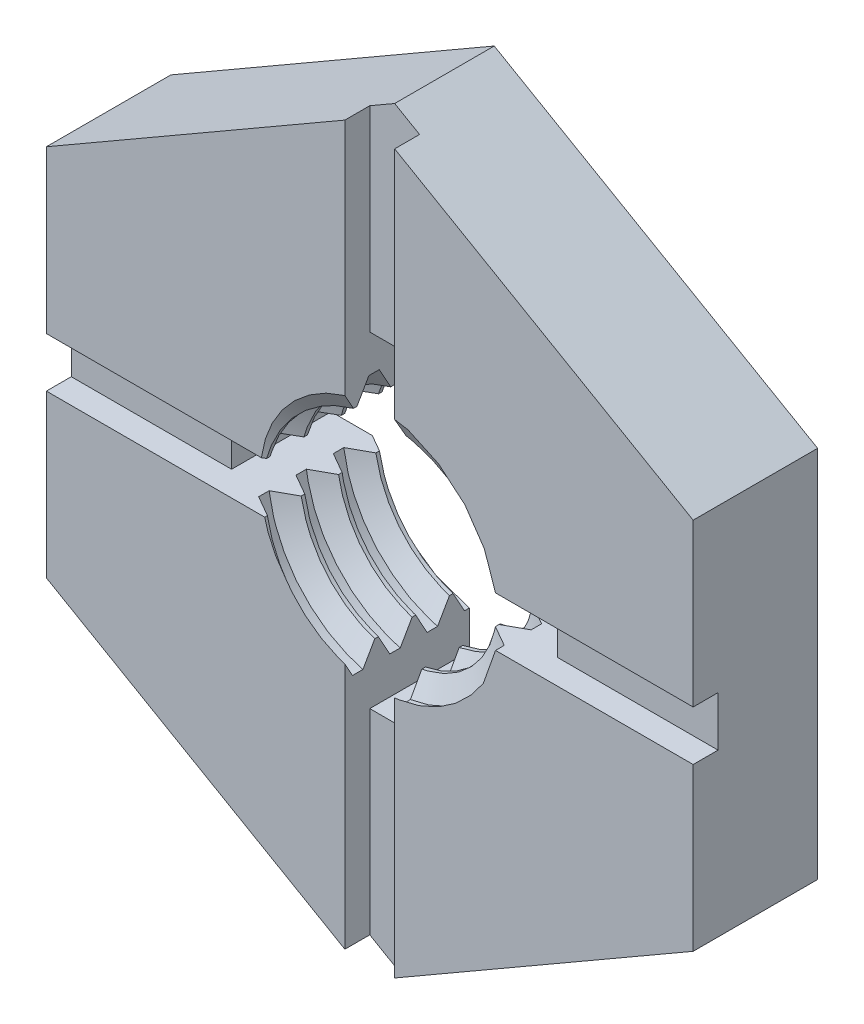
SolidWorks part; units mm, degrees
ref_plane "Спереди" through (0, 0, 0) normal (0, 0, 1) x (1, 0, 0)
ref_plane "Сверху" through (0, 0, 0) normal (0, 1, 0) x (1, 0, 0)
ref_plane "Справа" through (0, 0, 0) normal (1, 0, 0) x (0, 0, -1)
sketch "Эскиз1" plane through (0, 0, 0) normal (0, 0, 1) x (1, 0, 0)
  line L0 (-21.7519, 32.5498) -> (-21.7519, -22.4472) construction
  line L1 (-37.2424, 11.4339) -> (0.0071, 11.4339) construction
  line L2 (-50.4459, 3.9339) -> (7.1015, 3.9339) construction
  line L3 (-34.7423, 11.4339) -> (-21.7519, 18.9339)
  line L4 (-4.6381, -3.5661) -> (-44.0301, -3.5661) construction
  line L5 (-21.7519, 18.9339) -> (-8.7615, 11.4339)
  line L6 (-8.7615, 11.4339) -> (-8.7615, -3.5661)
  line L7 (-8.7615, -3.5661) -> (-21.7519, -11.0661)
  line L8 (-21.7519, -11.0661) -> (-34.7423, -3.5661)
  line L9 (-34.7423, -3.5661) -> (-34.7423, 11.4339)
  circle A1 centre (-21.7519, 3.9339) radius 15 construction
  circle A2 centre (-21.7519, 18.9339) radius 15 construction
  circle A3 centre (-21.7519, -11.0661) radius 15 construction
  dimension "D1" = 30
  dimension "D2" = 30
  dimension "D3" = 15
  dimension "D4" = 15
  dimension "D5" = 15
  dimension "D6" = 15
extrude "Бобышка-Вытянуть1" add sketch "Эскиз1" along normal blind 5
other "Отступ1" parameters "D1"=10, "D2"=0.2
sketch "Эскиз4" plane through (0, 0, 5) normal (0, 0, 1) x (1, 0, 0)
  line L0 (-39.49, 3.9339) -> (-6.1401, 3.9339) construction
  line L1 (-21.7519, 21.2243) -> (-21.7519, -13.0881) construction
  line L2 (-28.3019, 4.9339) -> (-15.2019, 4.9339)
  line L3 (-28.3019, 2.9339) -> (-15.2019, 2.9339)
  line L4 (-22.7519, 10.4839) -> (-22.7519, -2.6161)
  line L5 (-20.7519, 10.4839) -> (-20.7519, -2.6161)
  line L6 (-8.7615, -3.5661) -> (-8.7615, 11.4339)
  line L7 (-8.7615, 11.4339) -> (-21.7519, 18.9339)
  line L8 (-21.7519, 18.9339) -> (-34.7423, 11.4339)
  line L9 (-34.7423, 11.4339) -> (-34.7423, -3.5661)
  line L10 (-34.7423, -3.5661) -> (-21.7519, -11.0661)
  line L11 (-21.7519, -11.0661) -> (-8.7615, -3.5661)
  line L12 (-8.7615, -3.5661) -> (-8.7615, 11.4339)
  line L13 (-8.7615, 11.4339) -> (-21.7519, 18.9339)
  line L14 (-21.7519, 18.9339) -> (-34.7423, 11.4339)
  line L15 (-34.7423, 11.4339) -> (-34.7423, -3.5661)
  line L16 (-34.7423, -3.5661) -> (-21.7519, -11.0661)
  line L17 (-21.7519, -11.0661) -> (-8.7615, -3.5661)
  line L18 (-22.7519, 10.4839) -> (-20.7519, 10.4839)
  line L19 (-22.7519, -2.6161) -> (-20.7519, -2.6161)
  line L20 (-28.3019, 4.9339) -> (-28.3019, 2.9339)
  line L21 (-15.2019, 4.9339) -> (-15.2019, 2.9339)
  line L22 (-26.0019, 5.5052) -> (-26.0019, 2.0869) construction
  line L23 (-17.5019, 5.2803) -> (-17.5019, 2.3567) construction
  line L24 (-23.1297, 8.1839) -> (-19.3965, 8.1839) construction
  line L25 (-23.1072, -0.3161) -> (-19.8688, -0.3161) construction
  circle A0 centre (-21.7519, 3.9339) radius 4.25
  dimension "D8" = 8.5
  dimension "D2" = 15
  dimension "D3" = 7.5
  dimension "D4" = 1
  dimension "D5" = 1
  dimension "D6" = 1
  dimension "D7" = 1
  dimension "D9" = 2.3
  dimension "D10" = 2.3
  dimension "D11" = 2.3
  dimension "D12" = 2.3
  dimension "D1" = 0
extrude "Вырез-Вытянуть1" cut sketch "Эскиз4" against normal up to surface (5 mm away)
sketch "Эскиз5" plane through (0, 0, 5) normal (0, 0, 1) x (1, 0, 0)
  line L0 (-20.7519, 10.4839) -> (-20.7519, 8.9405) construction
  line L1 (-16.6999, 4.9339) -> (-15.2019, 4.9339) construction
  line L2 (-16.6999, 2.9339) -> (-15.2019, 2.9339) construction
  line L6 (-22.7519, 18.3565) -> (-22.7519, -10.4888)
  line L7 (-20.7519, 18.3565) -> (-20.7519, -10.4888)
  line L8 (-34.7423, 4.9339) -> (-8.7615, 4.9339)
  line L9 (-34.7423, 2.9339) -> (-8.7615, 2.9339)
  line L10 (-22.7519, 10.4839) -> (-22.7519, 8.7746) construction
  line L12 (-8.7615, -3.5661) -> (-8.7615, 11.4339)
  line L13 (-8.7615, 11.4339) -> (-21.7519, 18.9339)
  line L14 (-21.7519, 18.9339) -> (-34.7423, 11.4339)
  line L15 (-34.7423, 11.4339) -> (-34.7423, -3.5661)
  line L16 (-34.7423, -3.5661) -> (-21.7519, -11.0661)
  line L17 (-21.7519, -11.0661) -> (-8.7615, -3.5661)
  line L18 (-8.7615, -3.5661) -> (-8.7615, 11.4339)
  line L19 (-8.7615, 11.4339) -> (-21.7519, 18.9339)
  line L20 (-21.7519, 18.9339) -> (-34.7423, 11.4339)
  line L21 (-34.7423, 11.4339) -> (-34.7423, -3.5661)
  line L22 (-34.7423, -3.5661) -> (-21.7519, -11.0661)
  line L23 (-21.7519, -11.0661) -> (-8.7615, -3.5661)
  dimension "D1" = 0
extrude "Вырез-Вытянуть2" cut sketch "Эскиз5" against normal blind 1 contours L9 L8 M14 M34 | L7 L6 M12 M13 M19 | L9 L8 M24 M11 | L7 L6 M29 M15 M16
